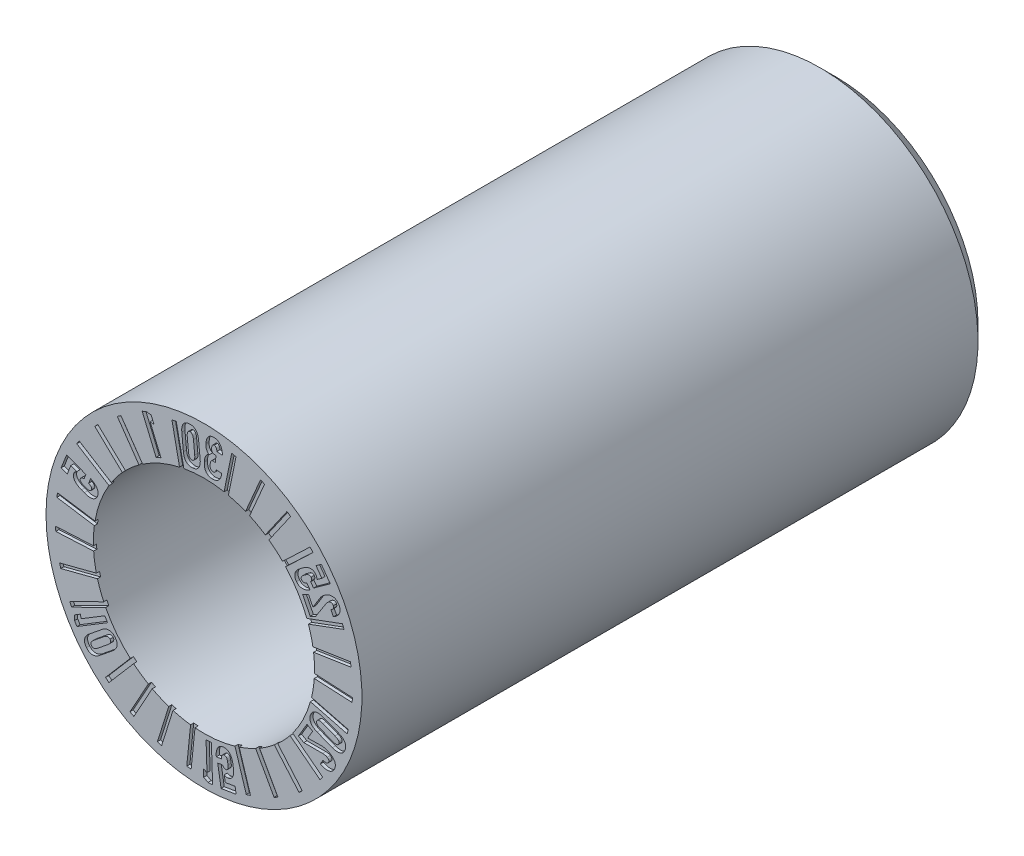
SolidWorks part; units mm, degrees
ref_plane "Front Plane" through (0, 0, 0) normal (0, 0, 1) x (1, 0, 0)
ref_plane "Top Plane" through (0, 0, 0) normal (0, 1, 0) x (1, 0, 0)
ref_plane "Right Plane" through (0, 0, 0) normal (1, 0, 0) x (0, 0, -1)
sketch "Sketch1" plane through (0, 0, 0) normal (1, 0, 0) x (0, 0, -1)
  line L0 (0, 0) -> (-75.3894, 0) construction
  line L2 (20, 2.5) -> (20, 4.5)
  line L4 (19.5, 5) -> (0, 5)
  line L5 (0, 5) -> (0, 3.5)
  line L7 (0, 3.5) -> (5, 3.5)
  line L8 (5, 3.5) -> (5, 1.25)
  line L9 (5, 1.25) -> (15, 1.25)
  line L10 (20, 2.5) -> (15, 2.5)
  line L11 (15, 1.25) -> (15, 2.5)
  line L12 (20, 4.5) -> (19.5, 5)
  point P6 (20, 5)
  dimension "D1" = 20
  dimension "D2" = 10
  dimension "D3" = 7
  dimension "D4" = 5
  dimension "D5" = 2.5
  dimension "D6" = 5
  dimension "D7" = 5
revolve "Revolve1" add sketch "Sketch1" angle 360 about L0
sketch "Sketch2" plane through (0, 0, 0) normal (0, 0, 1) x (1, 0, 0)
  line L0 (0, 0) -> (0, 6.5207) construction
  line L1 (0, 0) -> (1.3126, 6.3873) construction
  line L2 (0, 0) -> (2.5715, 5.9923) construction
  line L3 (0, 0) -> (3.7251, 5.352) construction
  line L4 (0, 0) -> (4.7262, 4.4926) construction
  line L5 (0, 0) -> (5.5338, 3.4492) construction
  line L6 (0, 0) -> (6.1148, 2.2647) construction
  line L7 (0, 0) -> (6.4455, 0.9874) construction
  line L8 (0, 0) -> (6.5124, -0.3303) construction
  line L9 (0, 0) -> (6.3126, -1.6344) construction
  line L10 (0, 0) -> (5.8543, -2.8717) construction
  line L11 (0, 0) -> (5.1564, -3.9914) construction
  line L12 (0, 0) -> (4.2474, -4.9477) construction
  line L13 (0, 0) -> (3.1645, -5.7014) construction
  line L14 (0, 0) -> (1.9521, -6.2217) construction
  line L15 (0, 0) -> (0.6597, -6.4873) construction
  line L16 (0, 0) -> (-0.6597, -6.4873) construction
  line L17 (0, 0) -> (-1.9521, -6.2217) construction
  line L18 (0, 0) -> (-3.1645, -5.7014) construction
  line L19 (0, 0) -> (-4.2474, -4.9477) construction
  line L20 (0, 0) -> (-5.1564, -3.9914) construction
  line L21 (0, 0) -> (-5.8543, -2.8717) construction
  line L22 (0, 0) -> (-6.3126, -1.6344) construction
  line L23 (0, 0) -> (-6.5124, -0.3303) construction
  line L24 (0, 0) -> (-6.4455, 0.9874) construction
  line L25 (0, 0) -> (-6.1148, 2.2647) construction
  line L26 (0, 0) -> (-5.5338, 3.4492) construction
  line L27 (0, 0) -> (-4.7262, 4.4926) construction
  line L28 (0, 0) -> (-3.7251, 5.352) construction
  line L29 (0, 0) -> (-2.5715, 5.9923) construction
  line L30 (0, 0) -> (-1.3126, 6.3873) construction
  line L31 (1.0147, 4.5897) -> (0.7127, 3.1204)
  line L36 (0.8775, 4.6179) -> (1.0147, 4.5897)
  line L37 (0.8775, 4.6179) -> (0.5756, 3.1486)
  line L38 (0.5756, 3.1486) -> (0.7127, 3.1204)
  line L39 (1.9178, 4.2915) -> (1.3263, 2.9131)
  line L40 (1.7891, 4.3467) -> (1.9178, 4.2915)
  line L41 (1.7891, 4.3467) -> (1.1976, 2.9683)
  line L42 (1.1976, 2.9683) -> (1.3263, 2.9131)
  line L43 (2.7424, 3.8176) -> (1.8855, 2.5865)
  line L44 (2.6275, 3.8976) -> (2.7424, 3.8176)
  line L45 (2.6275, 3.8976) -> (1.7706, 2.6664)
  line L46 (1.7706, 2.6664) -> (1.8855, 2.5865)
  line L47 (3.4548, 3.1874) -> (2.3676, 2.154)
  line L48 (3.3583, 3.2889) -> (3.4548, 3.1874)
  line L49 (3.3583, 3.2889) -> (2.2711, 2.2554)
  line L50 (2.2711, 2.2554) -> (2.3676, 2.154)
  line L55 (4.4317, 1.5667) -> (3.0251, 1.0457)
  line L56 (4.3831, 1.698) -> (4.4317, 1.5667)
  line L57 (4.3831, 1.698) -> (2.9765, 1.177)
  line L58 (2.9765, 1.177) -> (3.0251, 1.0457)
  line L59 (4.6564, 0.6425) -> (3.1737, 0.4154)
  line L60 (4.6352, 0.7809) -> (4.6564, 0.6425)
  line L61 (4.6352, 0.7809) -> (3.1525, 0.5538)
  line L62 (3.1525, 0.5538) -> (3.1737, 0.4154)
  line L63 (4.6904, -0.308) -> (3.1923, -0.232)
  line L64 (4.6975, -0.1681) -> (4.6904, -0.308)
  line L65 (4.6975, -0.1681) -> (3.1994, -0.0922)
  line L66 (3.1994, -0.0922) -> (3.1923, -0.232)
  line L67 (4.5324, -1.2458) -> (3.0803, -0.8699)
  line L68 (4.5675, -1.1103) -> (4.5324, -1.2458)
  line L69 (4.5675, -1.1103) -> (3.1154, -0.7343)
  line L70 (3.1154, -0.7343) -> (3.0803, -0.8699)
  line L75 (3.6738, -2.9323) -> (2.4876, -2.0141)
  line L76 (3.7595, -2.8215) -> (3.6738, -2.9323)
  line L77 (3.7595, -2.8215) -> (2.5733, -1.9034)
  line L78 (2.5733, -1.9034) -> (2.4876, -2.0141)
  line L79 (3.0083, -3.6118) -> (2.0313, -2.4736)
  line L80 (3.1146, -3.5206) -> (3.0083, -3.6118)
  line L81 (3.1146, -3.5206) -> (2.1375, -2.3824)
  line L82 (2.1375, -2.3824) -> (2.0313, -2.4736)
  line L83 (2.2197, -4.1434) -> (1.4918, -2.8319)
  line L84 (2.3421, -4.0755) -> (2.2197, -4.1434)
  line L85 (2.3421, -4.0755) -> (1.6142, -2.7639)
  line L86 (1.6142, -2.7639) -> (1.4918, -2.8319)
  line L87 (1.3402, -4.5054) -> (0.8912, -3.0742)
  line L88 (1.4738, -4.4635) -> (1.3402, -4.5054)
  line L89 (1.4738, -4.4635) -> (1.0248, -3.0323)
  line L90 (1.0248, -3.0323) -> (0.8912, -3.0742)
  line L95 (-0.5451, -4.6688) -> (-0.3934, -3.1765)
  line L96 (-0.4059, -4.683) -> (-0.5451, -4.6688)
  line L97 (-0.4059, -4.683) -> (-0.2541, -3.1907)
  line L98 (-0.2541, -3.1907) -> (-0.3934, -3.1765)
  line L99 (-1.4738, -4.4635) -> (-1.0248, -3.0323)
  line L100 (-1.3402, -4.5054) -> (-1.4738, -4.4635)
  line L101 (-1.3402, -4.5054) -> (-0.8912, -3.0742)
  line L102 (-0.8912, -3.0742) -> (-1.0248, -3.0323)
  line L103 (-2.3421, -4.0755) -> (-1.6142, -2.7639)
  line L104 (-2.2197, -4.1434) -> (-2.3421, -4.0755)
  line L105 (-2.2197, -4.1434) -> (-1.4918, -2.8319)
  line L106 (-1.4918, -2.8319) -> (-1.6142, -2.7639)
  line L107 (-3.1146, -3.5206) -> (-2.1375, -2.3824)
  line L108 (-3.0083, -3.6118) -> (-3.1146, -3.5206)
  line L109 (-3.0083, -3.6118) -> (-2.0313, -2.4736)
  line L110 (-2.0313, -2.4736) -> (-2.1375, -2.3824)
  line L115 (-4.2505, -2.007) -> (-2.9038, -1.3464)
  line L116 (-4.1889, -2.1327) -> (-4.2505, -2.007)
  line L117 (-4.1889, -2.1327) -> (-2.8421, -1.4721)
  line L118 (-2.8421, -1.4721) -> (-2.9038, -1.3464)
  line L119 (-4.5675, -1.1103) -> (-3.1154, -0.7343)
  line L120 (-4.5324, -1.2458) -> (-4.5675, -1.1103)
  line L121 (-4.5324, -1.2458) -> (-3.0803, -0.8699)
  line L122 (-3.0803, -0.8699) -> (-3.1154, -0.7343)
  line L123 (-4.6975, -0.1681) -> (-3.1994, -0.0922)
  line L124 (-4.6904, -0.308) -> (-4.6975, -0.1681)
  line L125 (-4.6904, -0.308) -> (-3.1923, -0.232)
  line L126 (-3.1923, -0.232) -> (-3.1994, -0.0922)
  line L127 (-4.6352, 0.7809) -> (-3.1525, 0.5538)
  line L128 (-4.6564, 0.6425) -> (-4.6352, 0.7809)
  line L129 (-4.6564, 0.6425) -> (-3.1737, 0.4154)
  line L130 (-3.1737, 0.4154) -> (-3.1525, 0.5538)
  line L135 (-3.9516, 2.5455) -> (-2.6786, 1.7521)
  line L136 (-4.0257, 2.4267) -> (-3.9516, 2.5455)
  line L137 (-4.0257, 2.4267) -> (-2.7527, 1.6333)
  line L138 (-2.7527, 1.6333) -> (-2.6786, 1.7521)
  line L139 (-3.3583, 3.2889) -> (-2.2711, 2.2554)
  line L140 (-3.4548, 3.1874) -> (-3.3583, 3.2889)
  line L141 (-3.4548, 3.1874) -> (-2.3676, 2.154)
  line L142 (-2.3676, 2.154) -> (-2.2711, 2.2554)
  line L143 (-2.6275, 3.8976) -> (-1.7706, 2.6664)
  line L144 (-2.7424, 3.8176) -> (-2.6275, 3.8976)
  line L145 (-2.7424, 3.8176) -> (-1.8855, 2.5865)
  line L146 (-1.8855, 2.5865) -> (-1.7706, 2.6664)
  line L151 (-0.8775, 4.6179) -> (-0.5756, 3.1486)
  line L152 (-1.0147, 4.5897) -> (-0.8775, 4.6179)
  line L153 (-1.0147, 4.5897) -> (-0.7127, 3.1204)
  line L154 (-0.7127, 3.1204) -> (-0.5756, 3.1486)
  circle A0 centre (0, 0) radius 3.645 construction
  text T0 "         25                 30    1                5                   10                   15                 20" font "Bahnschrift" height 1.14
  point P36 (0, 0)
  point P162 (0, 0)
  dimension "D1" = 7.29
  dimension "D2" = 31
extrude "Cut-Extrude1" cut sketch "Sketch2" against normal blind 0.1
